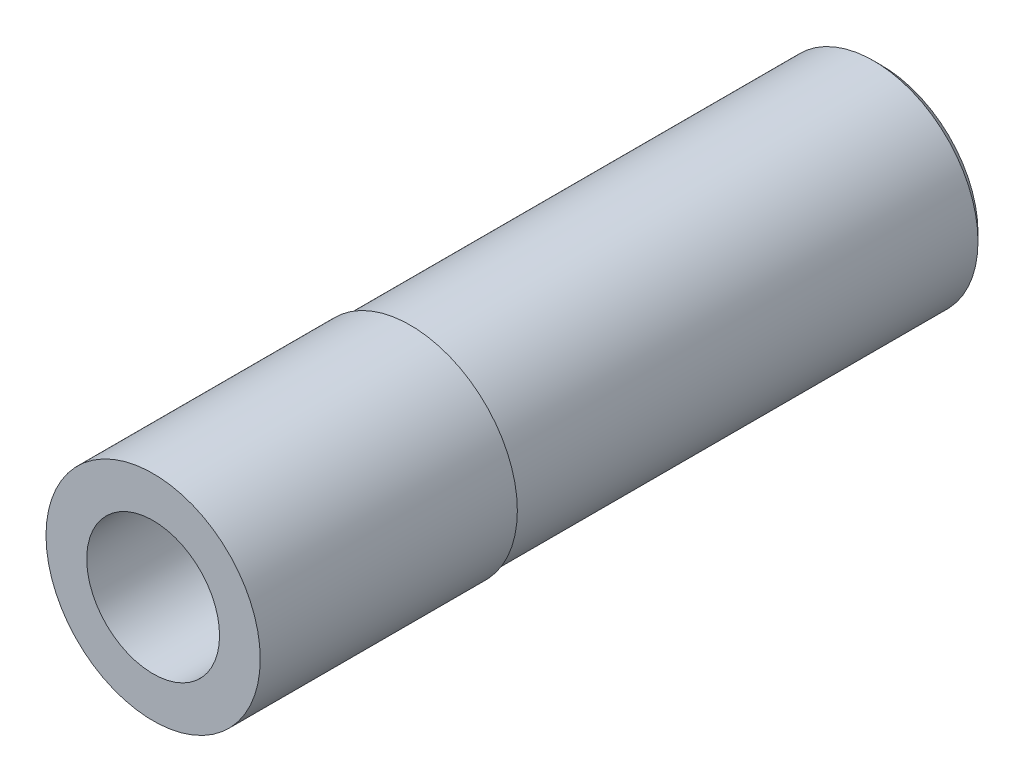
SolidWorks part; units mm, degrees
ref_plane "Front Plane" through (0, 0, 0) normal (0, 0, 1) x (1, 0, 0)
ref_plane "Top Plane" through (0, 0, 0) normal (0, 1, 0) x (1, 0, 0)
ref_plane "Right Plane" through (0, 0, 0) normal (1, 0, 0) x (0, 0, -1)
sketch "Sketch1" plane through (0, 0, 0) normal (1, 0, 0) x (0, 0, -1)
  line L2 (0, 2.5) -> (0, 1.55)
  line L3 (16.75, 2.5) -> (0, 2.5)
  line L4 (-3.7979, 0) -> (49996.2021, 0) construction
  line L8 (14, 0.8) -> (2.8, 0.8)
  line L9 (2.8, 1.55) -> (2.8, 0.8)
  line L10 (2.8, 1.55) -> (0, 1.55)
  line L12 (17, 1.5) -> (17, 2.25)
  line L16 (17, 2.25) -> (16.75, 2.5)
  line L17 (17, 1.5) -> (14, 1.5)
  line L18 (14, 0.8) -> (14, 1.5)
  dimension "D1" = 17
  dimension "D2" = 45
  dimension "D3" = 0.25
  dimension "D4" = 5
  dimension "D5" = 3.1
  dimension "D6" = 2.8
  dimension "D7" = 1.6
  dimension "D8" = 3
  dimension "D9" = 3
revolve "Revolve1" add sketch "Sketch1" angle 360 about L4
sketch "Sketch4" plane through (0, 0, 0) normal (1, 0, 0) x (0, 0, -1)
  line L0 (0, 0) -> (50000, 0) construction
  line L1 (17, -2.25) -> (17, 2.25) construction
  line L2 (6, 3.435) -> (17, 3.435)
  line L3 (6, 3.435) -> (6, 2.435)
  line L4 (6, 2.435) -> (17, 2.435)
  line L5 (17, 3.435) -> (17, 2.435)
  line L6 (16.75, 2.5) -> (0, 2.5) construction
  line L7 (0, 2.5) -> (0, -2.5) construction
  dimension "D1" = 1
  dimension "D2" = 0.065
  dimension "D3" = 6
revolve "Cut-Revolve1" cut sketch "Sketch4" angle 360 about L0
sketch "Sketch3" plane through (0, 0, -2.8) normal (0, 0, 1) x (1, 0, 0)
  line L0 (0, 0) -> (0, 50000) construction
  line L1 (0.4619, 0.8) -> (-0.4619, 0.8)
  line L2 (-0.4619, 0.8) -> (-0.9238, 0)
  line L3 (-0.9238, 0) -> (-0.4619, -0.8)
  line L4 (-0.4619, -0.8) -> (0.4619, -0.8)
  line L5 (0.4619, -0.8) -> (0.9238, 0)
  line L6 (0.9238, 0) -> (0.4619, 0.8)
  line L7 (0, 0) -> (50000, 0) construction
  circle A0 centre (0, 0) radius 0.8 construction
  circle A1 centre (0, 0) radius 0.8 construction
extrude "Cut-Extrude2" cut sketch "Sketch3" against normal blind 1.4
